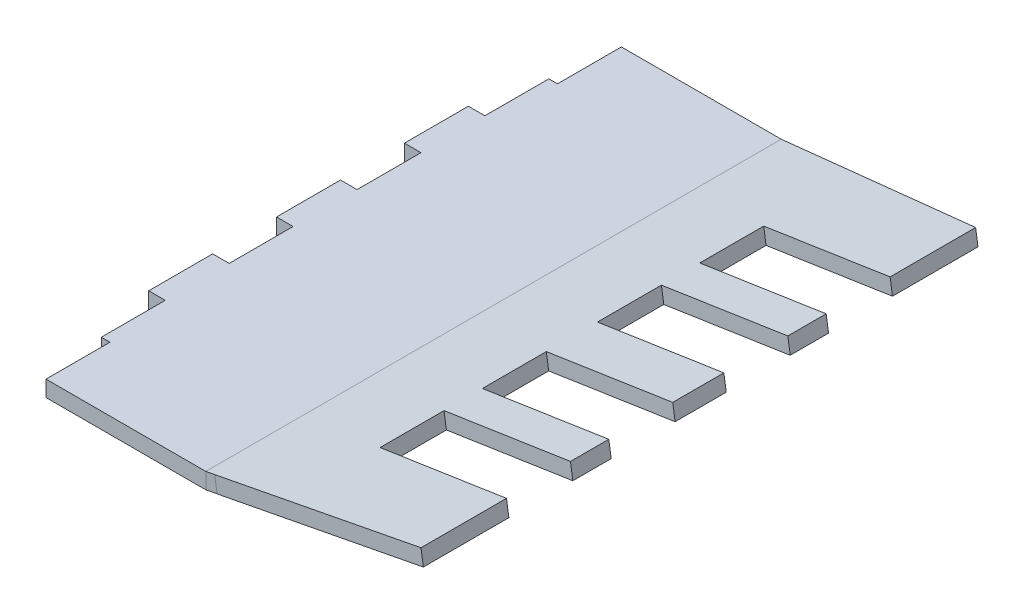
SolidWorks part; units mm, degrees
ref_plane "Front Plane" through (0, 0, 0) normal (0, 0, 1) x (1, 0, 0)
ref_plane "Top Plane" through (0, 0, 0) normal (0, 1, 0) x (1, 0, 0)
ref_plane "Right Plane" through (0, 0, 0) normal (1, 0, 0) x (0, 0, -1)
sketch "Sketch1" plane through (0, 0, 0) normal (0, 0, 1) x (1, 0, 0)
  line L0 (465.0954, 1074.1653) -> (-98.1545, 988.5795)
  line L1 (-98.1545, 988.5795) -> (465.0954, 1074.1653) construction
  line L2 (-98.0746, 983.5795) -> (-70.8081, 983.5795) construction
  line L3 (-98.1545, 988.5795) -> (-344.4491, 951.1551) construction
  line L5 (-134.9046, 988.5795) -> (-134.9046, 983.5795) construction
  line L8 (-134.9046, 983.5795) -> (-98.0746, 983.5795)
  line L9 (-98.0746, 983.5795) -> (465.0954, 1069.1532)
  line L10 (465.0954, 1069.1532) -> (465.0954, 1074.1653)
  line L11 (-98.1545, 988.5795) -> (-134.9046, 988.5795)
  line L12 (-134.9046, 988.5795) -> (-134.9046, 983.5795)
  dimension "D1" = 36.83
  dimension "D2" = 600
  dimension "D3" = 5
  dimension "D4" = 8.64
extrude "Boss-Extrude1" add sketch "Sketch1" against normal blind 114.3 contours L0 L11 L12 L8 L9 L10
sketch "Sketch3" plane through (0, 988.5795, 0) normal (0, 1, 0) x (1, 0, 0)
  line L0 (465.0954, 114.3) -> (465.0954, 0) construction
  line L1 (465.0954, 85.725) -> (465.0954, 28.575)
  line L2 (-98.0746, 0) -> (465.0954, 28.575)
  line L3 (-98.0746, 114.3) -> (465.0954, 85.725)
  line L4 (-98.0746, 114.3) -> (465.0954, 114.3)
  line L5 (465.0954, 114.3) -> (465.0954, 85.725)
  line L6 (-98.0746, 0) -> (465.0954, 0)
  line L7 (465.0954, 0) -> (465.0954, 28.575)
  point P6 (465.0954, 57.15)
  dimension "D1" = 57.15
  dimension "D2" = 57.15
  dimension "D3" = 28.575
extrude "Cut-Extrude3" cut sketch "Sketch3" along normal up to surface (0.0121 mm away) contours L5 L4 L3 | L7 L6 L2
sketch "Sketch4" plane through (0, 988.5795, 0) normal (0, 1, 0) x (1, 0, 0)
  line L0 (-98.1545, 114.3) -> (-65.169, 114.3)
  line L1 (-65.169, 114.3) -> (-65.169, 112.6304)
  line L2 (-65.169, 112.6304) -> (-98.1545, 114.3)
  line L3 (-98.0746, 0) -> (-65.169, 1.6696)
  line L4 (-65.169, 1.6696) -> (-65.169, 0)
  line L5 (-65.169, 0) -> (-98.0746, 0)
  line L6 (-98.0746, 114.3) -> (-98.1545, 114.3) construction
  dimension "D1" = 2.905
extrude "Cut-Extrude6" cut sketch "Sketch4" along normal through all both and the other way through all
sketch "Sketch6" plane through (0, 988.5795, 0) normal (0, 1, 0) x (1, 0, 0)
  line L0 (465.0954, 85.725) -> (465.0954, 79.375)
  line L1 (465.0954, 85.725) -> (465.0954, 28.575) construction
  line L2 (465.0954, 79.375) -> (455.0954, 79.375)
  line L3 (455.0954, 79.375) -> (455.0954, 86.2324)
  line L4 (-65.169, 112.6304) -> (465.0954, 85.725) construction
  line L5 (455.0954, 86.2324) -> (465.0954, 85.725)
  line L6 (465.0954, 28.575) -> (465.0954, 34.925)
  line L7 (465.0954, 34.925) -> (455.0954, 34.925)
  line L8 (455.0954, 34.925) -> (455.0954, 28.0676)
  line L9 (-98.0746, 0) -> (465.0954, 28.575) construction
  line L10 (455.0954, 28.0676) -> (465.0954, 28.575)
  line L11 (455.0954, 79.375) -> (455.0954, 66.675)
  line L12 (465.0954, 47.625) -> (455.0954, 47.625)
  line L13 (465.0954, 47.625) -> (465.0954, 66.675)
  line L14 (465.0954, 66.675) -> (455.0954, 66.675)
  line L15 (455.0954, 47.625) -> (455.0954, 66.675)
  line L16 (465.0954, 79.375) -> (465.0954, 66.675)
  line L17 (455.0954, 47.625) -> (455.0954, 34.925)
  line L18 (465.0954, 47.625) -> (465.0954, 34.925)
  dimension "D1" = 6.35
  dimension "D2" = 10
  dimension "D3" = 6.35
  dimension "D4" = 10
  dimension "D5" = 19.05
  dimension "D6" = 12.7
  dimension "D7" = 10
extrude "Cut-Extrude8" cut sketch "Sketch6" along normal up to surface (85.5858 mm away) contours L16 L2 L11 L14 | L18 L12 L17 L7
ref_plane "Plane1" through (0, 1074.1795, 0) normal (0, 1, 0) x (1, 0, 0)
sketch "Sketch9" plane through (-0.2518, 0, -4.9635) normal (0.0507, 0, 0.9987) x (0.9987, 0, -0.0507)
  line L0 (455.9086, 1074.1737) -> (455.9086, 1072.6421) construction
  line L1 (-97.9486, 988.5917) -> (465.9459, 1074.1653) construction
  dimension "D1" = 1.5316
ref_plane "Plane2" through (0, 1072.6421, 0) normal (0, 1, 0) x (1, 0, 0)
sketch "Sketch8" plane through (0, 1074.1795, 0) normal (0, 1, 0) x (1, 0, 0)
  line L0 (465.0954, 79.375) -> (455.0954, 79.375)
  line L1 (455.0954, 79.375) -> (455.0954, 86.2324)
  line L2 (-65.169, 112.6304) -> (465.0954, 85.725) construction
  line L3 (455.0954, 86.2324) -> (465.0954, 85.725)
  line L4 (465.0954, 85.725) -> (465.0954, 79.375)
  line L5 (455.0954, 66.675) -> (455.0954, 47.625)
  line L6 (455.0954, 47.625) -> (465.0954, 47.625)
  line L7 (465.0954, 47.625) -> (465.0954, 66.675)
  line L8 (465.0954, 66.675) -> (455.0954, 66.675)
  line L9 (465.0954, 28.575) -> (455.0954, 28.0676)
  line L10 (-98.0746, 0) -> (465.0954, 28.575) construction
  line L11 (455.0954, 28.0676) -> (455.0954, 34.925)
  line L12 (455.0954, 34.925) -> (465.0954, 34.925)
  line L13 (465.0954, 34.925) -> (455.0954, 34.925) construction
  line L14 (465.0954, 34.925) -> (465.0954, 28.575) construction
  line L15 (465.0954, 34.925) -> (465.0954, 28.575)
  dimension "D1" = 10
extrude "Cut-Extrude9" cut sketch "Sketch8" against normal up to surface and the other way through all
sketch "Sketch13" plane through (0, 988.5795, 0) normal (0, 1, 0) x (1, 0, 0)
  line L0 (-134.9046, 114.3) -> (-134.9046, 101.6)
  line L1 (-134.9046, 114.3) -> (-134.9046, 0) construction
  line L2 (-134.9046, 101.6) -> (-131.6191, 101.6)
  line L3 (-131.6191, 101.6) -> (-131.6191, 114.3)
  line L4 (-98.1545, 114.3) -> (-134.9046, 114.3) construction
  line L5 (-131.6191, 114.3) -> (-134.9046, 114.3)
  line L6 (-131.6191, 101.6) -> (-134.9046, 101.6)
  line L7 (-134.9046, 101.6) -> (-134.9046, 88.9)
  line L8 (-134.9046, 88.9) -> (-131.6191, 88.9)
  line L9 (-131.6191, 88.9) -> (-131.6191, 101.6)
  line L10 (-131.6191, 88.9) -> (-134.9046, 88.9)
  line L11 (-134.9046, 88.9) -> (-134.9046, 76.2)
  line L12 (-134.9046, 76.2) -> (-131.6191, 76.2)
  line L13 (-131.6191, 76.2) -> (-131.6191, 88.9)
  line L14 (-131.6191, 76.2) -> (-134.9046, 76.2)
  line L15 (-134.9046, 76.2) -> (-134.9046, 63.5)
  line L16 (-134.9046, 63.5) -> (-131.6191, 63.5)
  line L17 (-131.6191, 63.5) -> (-131.6191, 76.2)
  line L18 (-131.6191, 63.5) -> (-134.9046, 63.5)
  line L19 (-134.9046, 63.5) -> (-134.9046, 50.8)
  line L20 (-134.9046, 50.8) -> (-131.6191, 50.8)
  line L21 (-131.6191, 50.8) -> (-131.6191, 63.5)
  line L22 (-131.6191, 50.8) -> (-134.9046, 50.8)
  line L23 (-134.9046, 50.8) -> (-134.9046, 38.1)
  line L24 (-134.9046, 38.1) -> (-131.6191, 38.1)
  line L25 (-131.6191, 38.1) -> (-131.6191, 50.8)
  line L26 (-131.6191, 38.1) -> (-134.9046, 38.1)
  line L27 (-134.9046, 38.1) -> (-134.9046, 25.4)
  line L28 (-134.9046, 25.4) -> (-131.6191, 25.4)
  line L29 (-131.6191, 25.4) -> (-131.6191, 38.1)
  line L30 (-131.6191, 25.4) -> (-134.9046, 25.4)
  line L31 (-134.9046, 25.4) -> (-134.9046, 12.7)
  line L32 (-134.9046, 12.7) -> (-131.6191, 12.7)
  line L33 (-131.6191, 12.7) -> (-131.6191, 25.4)
  line L34 (-131.6191, 12.7) -> (-134.9046, 12.7)
  line L35 (-134.9046, 12.7) -> (-134.9046, 0)
  line L36 (-134.9046, 0) -> (-131.6191, 0)
  line L37 (-131.6191, 0) -> (-131.6191, 12.7)
  line L39 (-131.6191, 114.3) -> (-129.9046, 114.3)
  line L40 (-131.6191, 114.3) -> (-131.6191, 101.6)
  line L41 (-131.6191, 101.6) -> (-129.9046, 101.6)
  line L42 (-129.9046, 114.3) -> (-129.9046, 101.6)
  line L43 (-131.6191, 0) -> (-129.9046, 0)
  line L44 (-131.6191, 0) -> (-131.6191, 12.7)
  line L45 (-131.6191, 12.7) -> (-129.9046, 12.7)
  line L46 (-129.9046, 0) -> (-129.9046, 12.7)
  dimension "D1" = 3.2854
  dimension "D2" = 12.7
  dimension "D4" = 12.7
  dimension "D5" = 1.7146
  dimension "D6" = 12.7
  dimension "D7" = 1.7146
  dimension "D3" = 9
extrude "Cut-Extrude12" cut sketch "Sketch13" against normal through all both and the other way through all contours L37 L32 M5 M8 | L2 L3 M7 M8 | L32 L33 L28 M8 | L24 L25 L20 M8 | L16 L17 L12 M8 | L9 L6 L7 L8
sketch "Sketch14" plane through (-149.0397, 980.8475, 0) normal (-0.1502, 0.9887, 0) x (0.9887, 0.1502, 0)
  line L0 (249.1817, 10.211) -> (249.1817, 104.089) construction
  line L1 (249.1817, 104.089) -> (150.3474, 5.2531) construction
  line L2 (150.3474, 109.0435) -> (249.1817, 10.211) construction
  line L3 (343.0598, 10.211) -> (343.0598, 104.089) construction
  line L4 (343.0598, 104.089) -> (244.2255, 5.2531) construction
  line L5 (244.2255, 109.0435) -> (343.0598, 10.211) construction
  line L6 (56.4694, 109.0435) -> (155.3036, 10.211) construction
  line L7 (155.3036, 10.211) -> (155.3036, 104.089) construction
  line L8 (155.3036, 104.089) -> (56.4694, 5.2531) construction
  line L9 (436.9379, 10.211) -> (436.9379, 104.089) construction
  line L10 (436.9379, 104.089) -> (338.1036, 5.2531) construction
  line L11 (338.1036, 109.0435) -> (436.9379, 10.211) construction
  line L12 (606.0697, 32.8231) -> (606.0697, 81.4769)
  line L13 (606.0697, 81.4769) -> (84.5832, 107.6366)
  line L14 (84.5832, 107.6366) -> (56.4694, 109.0435)
  line L15 (56.4694, 109.0435) -> (56.4694, 5.2531)
  line L16 (56.4694, 5.2531) -> (606.0697, 32.8231)
  line L17 (606.0697, 32.8231) -> (606.0697, 81.4769)
  line L18 (606.0697, 81.4769) -> (84.5832, 107.6366)
  line L19 (84.5832, 107.6366) -> (56.4694, 109.0435)
  line L20 (56.4694, 109.0435) -> (56.4694, 5.2531)
  line L21 (56.4694, 5.2531) -> (606.0697, 32.8231)
  line L22 (530.816, 10.211) -> (530.816, 104.089) construction
  line L23 (530.816, 104.089) -> (431.9817, 5.2531) construction
  line L24 (431.9817, 109.0435) -> (530.816, 10.211) construction
  line L25 (624.6941, 10.211) -> (624.6941, 104.089) construction
  line L26 (624.6941, 104.089) -> (525.8598, 5.2531) construction
  line L27 (525.8598, 109.0435) -> (624.6941, 10.211) construction
  line L28 (718.5722, 10.211) -> (718.5722, 104.089) construction
  line L29 (718.5722, 104.089) -> (619.7379, 5.2531) construction
  line L30 (619.7379, 109.0435) -> (718.5722, 10.211) construction
  line L31 (812.4503, 10.211) -> (812.4503, 104.089) construction
  line L32 (812.4503, 104.089) -> (713.616, 5.2531) construction
  line L33 (713.616, 109.0435) -> (812.4503, 10.211) construction
  line L34 (54.7016, 107.2757) -> (153.5359, 8.4432)
  line L35 (153.5359, 105.8568) -> (54.7016, 7.0208)
  line L36 (148.5797, 107.2757) -> (251.6817, 4.1755)
  line L37 (251.6817, 4.1755) -> (251.6817, 104.089)
  line L38 (242.4578, 107.2757) -> (345.5598, 4.1755)
  line L39 (345.5598, 4.1755) -> (345.5598, 104.089)
  line L40 (336.3359, 107.2757) -> (439.4379, 4.1755)
  line L41 (439.4379, 4.1755) -> (439.4379, 104.089)
  line L42 (430.214, 107.2757) -> (533.316, 4.1755)
  line L43 (533.316, 4.1755) -> (533.316, 104.089)
  line L44 (524.0921, 107.2757) -> (622.9264, 8.4432)
  line L45 (622.9263, 105.8568) -> (524.0921, 7.0208)
  line L46 (58.2371, 110.8113) -> (157.0714, 11.9787)
  line L47 (157.0714, 102.3213) -> (58.2371, 3.4853)
  line L48 (152.1152, 110.8113) -> (246.6817, 16.2464)
  line L49 (246.6817, 16.2464) -> (246.6817, 104.089)
  line L50 (245.9933, 110.8113) -> (340.5598, 16.2464)
  line L51 (340.5598, 16.2464) -> (340.5598, 104.089)
  line L52 (339.8714, 110.8113) -> (434.4379, 16.2464)
  line L53 (434.4379, 16.2464) -> (434.4379, 104.089)
  line L54 (433.7495, 110.8113) -> (528.316, 16.2464)
  line L55 (528.316, 16.2464) -> (528.316, 104.089)
  line L56 (527.6276, 110.8113) -> (626.4619, 11.9787)
  line L57 (626.4619, 102.3213) -> (527.6276, 3.4853)
  line L58 (247.414, 105.8568) -> (148.5797, 7.0208)
  line L59 (157.8036, 10.211) -> (157.8036, 104.089)
  line L60 (341.2921, 105.8568) -> (242.4578, 7.0208)
  line L61 (435.1701, 105.8568) -> (336.3359, 7.0208)
  line L62 (529.0482, 105.8568) -> (430.214, 7.0208)
  line L63 (250.9495, 102.3213) -> (152.1152, 3.4853)
  line L64 (152.8036, 10.211) -> (152.8036, 104.089)
  line L65 (344.8276, 102.3213) -> (245.9933, 3.4853)
  line L66 (438.7057, 102.3213) -> (339.8714, 3.4853)
  line L67 (532.5838, 102.3213) -> (433.7495, 3.4853)
  dimension "D2" = 90
  dimension "D3" = 98.8343
  dimension "D1" = 5
  dimension "D5" = 2.5
  dimension "D6" = 2.5
  dimension "D7" = 2.5
  dimension "D8" = 2.5
  dimension "D4" = 8
extrude "Cut-Extrude13" cut sketch "Sketch14" against normal through all contours L35 L34 L20 | L19 L46 L35 L36 L18 | L46 L64 L47 | L58 L34 L47 L21 | L59 L58 L36 | L58 L18 L48 | L49 L63 L48 | L36 L63 L21 | L60 L38 L37 | L60 L18 L50 | L18 L65 L50 L21 L51 | L38 L65 L21 | L61 L40 L18 L39 L21 | L61 L18 L52 | L18 L66 L52 L21 L53 | L40 L66 L21 | L62 L42 L18 L41 L21 | L62 L18 L54 | L18 L67 L54 L21 L55 | L42 L67 L21 | L45 L44 L18 L43 L21 | L18 L56 L45 | L44 L57 L21 | L18 L57 L56 L21 L17
sketch "Sketch15" plane through (-149.0397, 980.8475, 0) normal (-0.1502, 0.9887, 0) x (0.9887, 0.1502, 0)
  line L0 (108.3646, 9.9195) -> (108.3646, 111.45)
  line L3 (84.8334, 112.6304) -> (611.0697, 86.2324) construction
  line L4 (108.3646, 111.45) -> (108.3646, 2.85)
  line L5 (51.5502, 0) -> (611.0697, 28.0676) construction
  line L6 (108.3646, 2.85) -> (53.1685, 0.0812)
  line L7 (53.1685, 0.0812) -> (53.1685, 114.215)
  line L8 (84.8334, 112.6304) -> (51.4694, 114.3) construction
  line L9 (53.1685, 114.215) -> (108.3646, 111.45)
  point P4 (108.3646, 60.6847)
extrude "Boss-Extrude2" add sketch "Sketch15" against normal up to surface (4.9553 mm away) contours L9 L7 L6 L4 L0
sketch "Sketch16" plane through (-149.0397, 980.8475, 0) normal (-0.1502, 0.9887, 0) x (0.9887, 0.1502, 0)
  line L0 (51.4694, 57.15) -> (108.3646, 57.15) construction
  line L1 (51.4694, 114.3) -> (51.4694, 0) construction
  line L2 (108.3646, 60.6847) -> (108.3646, 53.6136) construction
  line L3 (79.917, 57.15) -> (79.917, 112.8764) construction
  line L4 (84.8334, 112.6304) -> (53.1685, 114.215) construction
  line L5 (79.917, 112.8764) -> (79.917, 1.423) construction
  line L6 (108.3646, 2.85) -> (53.1685, 0.0812) construction
  line L7 (620.9557, 28.575) -> (620.9557, 34.925) construction
  line L8 (620.9557, 34.925) -> (611.0692, 34.925) construction
  line L9 (611.0692, 34.925) -> (611.0692, 28.0676) construction
  line L10 (611.0692, 28.0676) -> (620.9557, 28.575) construction
  line L11 (620.9557, 79.375) -> (620.9557, 85.725) construction
  line L12 (620.9557, 85.725) -> (611.0692, 86.2324) construction
  line L13 (611.0692, 86.2324) -> (611.0692, 79.375) construction
  line L14 (611.0692, 79.375) -> (620.9557, 79.375) construction
  line L15 (620.9557, 66.675) -> (611.0692, 66.675) construction
  line L16 (611.0692, 66.675) -> (611.0692, 47.625) construction
  line L17 (611.0692, 47.625) -> (620.9557, 47.625) construction
  line L18 (620.9557, 47.625) -> (620.9557, 66.675) construction
  line L19 (611.0697, 86.2324) -> (108.3646, 111.45) construction
  line L20 (108.3646, 111.45) -> (84.8334, 112.6304) construction
  line L21 (53.1685, 114.215) -> (51.4694, 114.3) construction
  line L22 (51.4694, 0) -> (51.5502, 0) construction
  line L23 (51.5502, 0) -> (53.1685, 0.0812) construction
  line L24 (53.1685, 0.0812) -> (108.3646, 2.85) construction
  line L25 (108.3646, 2.85) -> (611.0697, 28.0676) construction
  line L26 (611.0697, 28.0676) -> (611.0697, 86.2324) construction
  line L27 (18.3845, 114.3) -> (18.3845, 88.9) construction
  line L28 (18.3845, 88.9) -> (15.1363, 88.9) construction
  line L29 (15.1363, 88.9) -> (15.1363, 76.2) construction
  line L30 (15.1363, 76.2) -> (18.3845, 76.2) construction
  line L31 (18.3845, 76.2) -> (18.3845, 63.5) construction
  line L32 (18.3845, 63.5) -> (15.1363, 63.5) construction
  line L33 (15.1363, 63.5) -> (15.1363, 50.8) construction
  line L34 (15.1363, 50.8) -> (18.3845, 50.8) construction
  line L35 (18.3845, 50.8) -> (18.3845, 38.1) construction
  line L36 (18.3845, 38.1) -> (15.1363, 38.1) construction
  line L37 (15.1363, 38.1) -> (15.1363, 25.4) construction
  line L38 (15.1363, 25.4) -> (18.3845, 25.4) construction
  line L39 (18.3845, 25.4) -> (18.3845, 0) construction
  line L40 (18.3845, 0) -> (51.4694, 0) construction
  line L41 (51.4694, 114.3) -> (18.3845, 114.3) construction
  line L42 (620.9557, 28.575) -> (620.9557, 34.925)
  line L43 (620.9557, 34.925) -> (611.0692, 34.925)
  line L44 (611.0692, 34.925) -> (611.0692, 28.0676)
  line L45 (611.0692, 28.0676) -> (620.9557, 28.575)
  line L46 (620.9557, 79.375) -> (620.9557, 85.725)
  line L47 (620.9557, 85.725) -> (611.0692, 86.2324)
  line L48 (611.0692, 86.2324) -> (611.0692, 79.375)
  line L49 (611.0692, 79.375) -> (620.9557, 79.375)
  line L50 (620.9557, 66.675) -> (611.0692, 66.675)
  line L51 (611.0692, 66.675) -> (611.0692, 47.625)
  line L52 (611.0692, 47.625) -> (620.9557, 47.625)
  line L53 (620.9557, 47.625) -> (620.9557, 66.675)
  line L54 (611.0697, 86.2324) -> (108.3646, 111.45)
  line L55 (108.3646, 111.45) -> (84.8334, 112.6304)
  line L56 (84.8334, 112.6304) -> (53.1685, 114.215)
  line L57 (53.1685, 114.215) -> (51.4694, 114.3)
  line L58 (51.4694, 0) -> (51.5502, 0)
  line L59 (51.5502, 0) -> (53.1685, 0.0812)
  line L60 (53.1685, 0.0812) -> (108.3646, 2.85)
  line L61 (108.3646, 2.85) -> (611.0697, 28.0676)
  line L62 (611.0697, 28.0676) -> (611.0697, 86.2324)
  line L63 (18.3845, 114.3) -> (18.3845, 88.9)
  line L64 (18.3845, 88.9) -> (15.1363, 88.9)
  line L65 (15.1363, 88.9) -> (15.1363, 76.2)
  line L66 (15.1363, 76.2) -> (18.3845, 76.2)
  line L67 (18.3845, 76.2) -> (18.3845, 63.5)
  line L68 (18.3845, 63.5) -> (15.1363, 63.5)
  line L69 (15.1363, 63.5) -> (15.1363, 50.8)
  line L70 (15.1363, 50.8) -> (18.3845, 50.8)
  line L71 (18.3845, 50.8) -> (18.3845, 38.1)
  line L72 (18.3845, 38.1) -> (15.1363, 38.1)
  line L73 (15.1363, 38.1) -> (15.1363, 25.4)
  line L74 (15.1363, 25.4) -> (18.3845, 25.4)
  line L75 (18.3845, 25.4) -> (18.3845, 0)
  line L76 (18.3845, 0) -> (51.4694, 0)
  line L77 (51.4694, 114.3) -> (18.3845, 114.3)
  line L78 (92.617, 95.25) -> (67.217, 95.25)
  line L79 (67.217, 95.25) -> (67.217, 82.55)
  line L80 (67.217, 82.55) -> (92.617, 82.55)
  line L81 (92.617, 82.55) -> (92.617, 95.25)
  line L84 (92.617, 62.23) -> (67.217, 62.23)
  line L87 (79.917, 74.93) -> (92.617, 74.93)
  line L89 (92.617, 74.93) -> (92.617, 62.23)
  line L90 (79.917, 74.93) -> (67.217, 74.93)
  line L91 (67.217, 74.93) -> (67.217, 62.23)
  line L92 (67.217, 31.75) -> (92.617, 31.75)
  line L93 (67.217, 19.05) -> (67.217, 31.75)
  line L94 (92.617, 19.05) -> (67.217, 19.05)
  line L95 (92.617, 31.75) -> (92.617, 19.05)
  line L96 (79.917, 39.37) -> (67.217, 39.37)
  line L97 (79.917, 39.37) -> (92.617, 39.37)
  line L98 (92.617, 39.37) -> (92.617, 52.07)
  line L99 (92.617, 52.07) -> (67.217, 52.07)
  line L100 (67.217, 39.37) -> (67.217, 52.07)
  line L101 (67.217, 95.25) -> (67.217, 113.512)
  line L102 (67.217, 113.512) -> (67.217, 0.7859)
  line L103 (92.617, 95.25) -> (92.617, 112.2399)
  line L104 (92.617, 112.2399) -> (92.617, 2.0601)
  point P52 (79.917, 95.25)
  dimension "D1" = 25.4
  dimension "D2" = 12.7
  dimension "D3" = 12.7
  dimension "D4" = 7.62
  dimension "D5" = 12.7
  dimension "D6" = 5.08
  dimension "D7" = 12.7
extrude "Cut-Extrude14" cut sketch "Sketch16" against normal through all both and the other way through all contours L81 L104 L89 L98 L95 L60 L61 L62 L45 L44 L43 L52 L51 L50 L49 L48 L47 L54 L55 L103 | L100 L96 L97 L98 L99 | L95 L92 L93 L94 | L90 L91 L84 L89 L87 | L80 L81 L78 L79 | L62 L52 L53 L50 | L62 L49 L46 L47 | L62 L45 L42 L43
ref_plane "Plane3" through (455.096, 1072.6421, -66.675) normal (0, 0, -1) x (-1, 0, 0)
sketch "Sketch17" plane through (455.096, 1072.6421, -66.675) normal (0, 0, -1) x (-1, 0, 0)
  line L0 (-24.5703, 19.307) -> (22.8601, 19.307)
  line L1 (22.8601, 19.307) -> (22.8601, -32.9158)
  line L2 (22.8601, -32.9158) -> (-24.5703, -32.9158)
  line L3 (-24.5703, -32.9158) -> (-24.5703, 19.307)
extrude "Cut-Extrude15" cut sketch "Sketch17" along normal through all both and the other way through all
sketch "Sketch18" plane through (0, 0, -114.3) normal (0, 0, -1) x (-1, 0, 0)
  line L0 (98.0746, 983.5795) -> (95.7302, 983.9358) construction
  line L1 (131.6191, 983.5795) -> (98.1545, 983.5795) construction
  line L2 (95.7302, 983.9358) -> (56.7294, 989.8619) construction
  line L3 (98.0746, 983.5795) -> (95.7302, 983.9358)
  line L4 (131.6191, 983.5795) -> (98.1545, 983.5795)
  line L5 (95.7302, 983.9358) -> (56.7294, 989.8619)
  line L6 (98.2124, 985.4045) -> (96.0044, 985.74)
  line L7 (96.0044, 985.74) -> (57.0036, 991.6662)
  line L8 (131.6191, 985.4045) -> (98.2124, 985.4045)
  line L9 (131.6191, 985.4045) -> (134.9046, 985.4045)
  line L10 (134.9046, 983.5795) -> (134.9046, 988.5795) construction
  line L11 (134.9046, 985.4045) -> (134.9046, 983.5795)
  line L12 (134.9046, 983.5795) -> (131.6191, 983.5795)
  line L13 (57.0036, 991.6662) -> (56.7294, 989.8619)
  line L14 (98.1545, 983.5795) -> (98.0746, 983.5795)
  line L15 (98.3487, 985.3838) -> (96.0044, 985.74) construction
  line L16 (131.6191, 985.4045) -> (98.1545, 985.4045) construction
  dimension "D1" = 1.825
extrude "Cut-Extrude16" cut sketch "Sketch18" against normal through all both and the other way through all
sketch "Sketch19" plane through (0, 988.5795, 0) normal (0, 1, 0) x (1, 0, 0)
  line L0 (-131.6191, 0) -> (-129.9046, 0) construction
  line L1 (-129.9046, 0) -> (-129.9046, 12.7) construction
  line L2 (-131.6191, 0) -> (-131.6191, 12.7) construction
  line L3 (-131.6191, 12.7) -> (-129.9046, 12.7) construction
  line L4 (-131.6191, 114.3) -> (-129.9046, 114.3) construction
  line L5 (-131.6191, 101.6) -> (-131.6191, 114.3) construction
  line L6 (-131.6191, 101.6) -> (-129.9046, 101.6) construction
  line L7 (-129.9046, 114.3) -> (-129.9046, 101.6) construction
  line L8 (-131.6191, 0) -> (-129.9046, 0)
  line L9 (-129.9046, 0) -> (-129.9046, 12.7)
  line L10 (-131.6191, 0) -> (-131.6191, 12.7)
  line L11 (-131.6191, 12.7) -> (-129.9046, 12.7)
  line L12 (-131.6191, 114.3) -> (-129.9046, 114.3)
  line L13 (-131.6191, 101.6) -> (-131.6191, 114.3)
  line L14 (-131.6191, 101.6) -> (-129.9046, 101.6)
  line L15 (-129.9046, 114.3) -> (-129.9046, 101.6)
extrude "Cut-Extrude17" cut sketch "Sketch19" against normal blind 10
